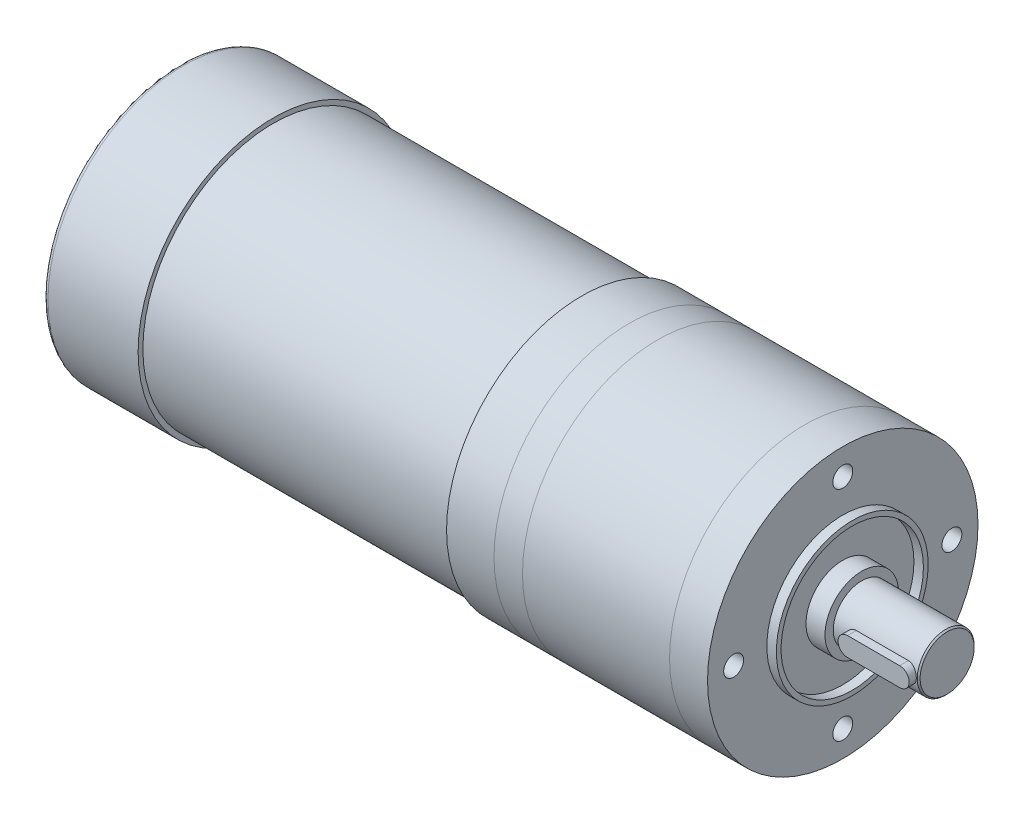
SolidWorks part; units mm, degrees
ref_plane "前视基准面" through (0, 0, 0) normal (0, 0, 1) x (1, 0, 0)
ref_plane "上视基准面" through (0, 0, 0) normal (0, 1, 0) x (1, 0, 0)
ref_plane "右视基准面" through (0, 0, 0) normal (1, 0, 0) x (0, 0, -1)
sketch "草图1" plane through (0, 0, 0) normal (1, 0, 0) x (0, 0, -1)
  circle A0 centre (0, 0) radius 28.5
extrude "凸台-拉伸1" add sketch "草图1" against normal blind 8
sketch "草图2" plane through (-8, 0, 0) normal (-1, 0, 0) x (0, 0, 1)
  circle A0 centre (0, 0) radius 28.5
extrude "凸台-拉伸2" add sketch "草图2" along normal blind 31 separate body
sketch "草图3" plane through (-39, 0, 0) normal (-1, 0, 0) x (0, 0, 1)
  circle A0 centre (0, 0) radius 28.5
extrude "凸台-拉伸3" add sketch "草图3" along normal blind 6 separate body
sketch "草图4" plane through (-45, 0, 0) normal (-1, 0, 0) x (0, 0, 1)
  circle A0 centre (0, 0) radius 28.5
extrude "凸台-拉伸4" add sketch "草图4" along normal blind 10 separate body
sketch "草图5" plane through (-55, 0, 0) normal (-1, 0, 0) x (0, 0, 1)
  circle A0 centre (0, 0) radius 27.5
extrude "凸台-拉伸5" add sketch "草图5" along normal blind 65
sketch "草图6" plane through (-120, 0, 0) normal (-1, 0, 0) x (0, 0, 1)
  circle A0 centre (0, 0) radius 28.5
extrude "凸台-拉伸6" add sketch "草图6" along normal blind 20
fillet "圆角1" radius 1 1 edges at (-140, 0, 28.5)
sketch "草图7" plane through (0, 0, 0) normal (1, 0, 0) x (0, 0, -1)
  circle A0 centre (0, 0) radius 16
  circle A1 centre (0, 0) radius 15
extrude "凸台-拉伸7" add sketch "草图7" along normal blind 2
sketch "草图8" plane through (0, 0, 0) normal (1, 0, 0) x (0, 0, -1)
  circle A0 centre (0, 0) radius 7.75
extrude "凸台-拉伸8" add sketch "草图8" along normal blind 4
sketch "草图9" plane through (4, 0, 0) normal (1, 0, 0) x (0, 0, -1)
  circle A0 centre (0, 0) radius 6
extrude "凸台-拉伸9" add sketch "草图9" along normal blind 18
sketch "草图10" plane through (0, 0, 0) normal (1, 0, 0) x (0, 0, -1)
  point P3 (0, 23)
  point P4 (23, 0)
  point P5 (0, -23)
  point P6 (-23, 0)
hole_wizard "M5 螺纹孔1" positions "3D草图1" profile "草图11" tap size "M5" standard "GB"
sketch3d "3D草图1"
  point P0 (0, 23, 0)
  point P3 (0, 0, -23)
  point P6 (0, -23, 0)
  point P9 (0, 0, 23)
sketch "草图11" plane through (0, 23, 0) normal (0, 1, 0) x (0, 0, -1)
  line L0 (0, 0) -> (0, 15.2618)
  line L1 (0, 15.2618) -> (2.1, 14)
  line L2 (2.1, 14) -> (2.1, 0)
  line L5 (2.1, 0) -> (0, 0)
  line L10 (0, 15.2618) -> (-2.1, 14) construction
  line L11 (0, -6.35) -> (0, 107.95) construction
  dimension "螺纹孔钻头直径" = 4.2
  dimension "螺纹孔钻头深度" = 14
  dimension "导头角度" = 118
ref_plane "基准面1" through (0, 0, 6) normal (0, 0, 1) x (1, 0, 0)
sketch "草图12" plane through (0, 0, 6) normal (0, 0, 1) x (1, 0, 0)
  line L3 (8.5, 2) -> (19.5, 2)
  line L5 (19.5, -2) -> (8.5, -2)
  arc A0 (19.5, -2) -> (19.5, 2) centre (19.5, 0) ccw
  arc A1 (8.5, 2) -> (8.5, -2) centre (8.5, 0) ccw
extrude "切除-拉伸1" cut sketch "草图12" against normal blind 2.5
sketch "草图13" plane through (0, 0, 3.5) normal (0, 0, 1) x (1, 0, 0)
  line L0 (8.5, 2) -> (19.5, 2)
  line L2 (19.5, -2) -> (8.5, -2)
  arc A0 (8.5, 2) -> (8.5, -2) centre (8.5, 0) ccw
  arc A1 (19.5, -2) -> (19.5, 2) centre (19.5, 0) ccw
extrude "凸台-拉伸10" add sketch "草图13" along normal blind 4 separate body
chamfer "倒角1" distance 0.3 angle 45 1 edges at (22, 0, -6)
